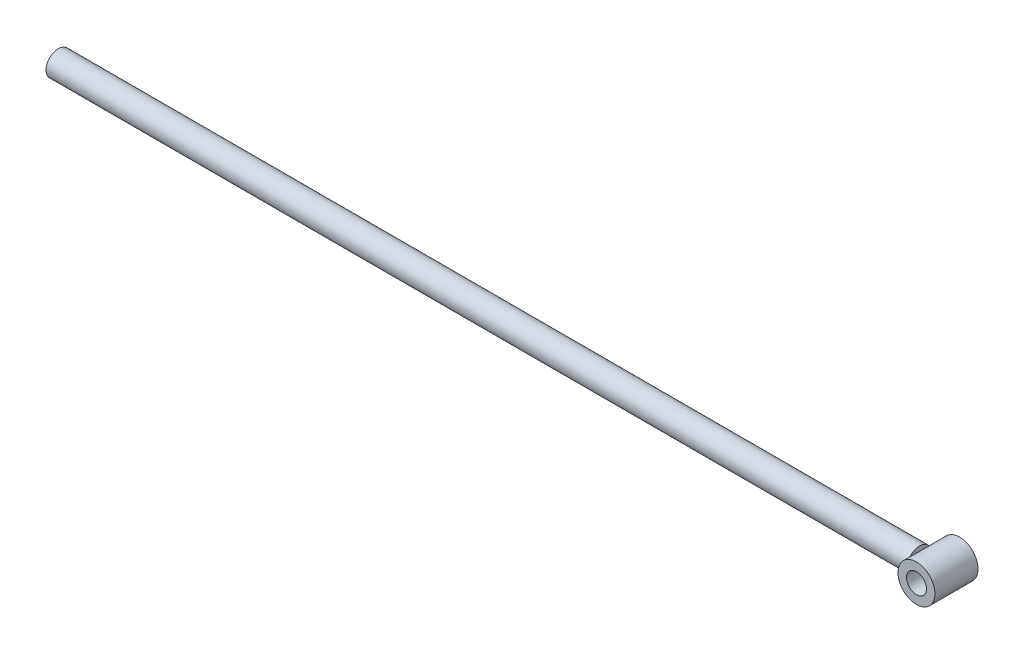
SolidWorks part; units mm, degrees
ref_plane "Plan de face" through (0, 0, 0) normal (0, 0, 1) x (1, 0, 0)
ref_plane "Plan de dessus" through (0, 0, 0) normal (0, 1, 0) x (1, 0, 0)
ref_plane "Plan de droite" through (0, 0, 0) normal (1, 0, 0) x (0, 0, -1)
sketch "Esquisse1" plane through (0, 0, 0) normal (1, 0, 0) x (0, 0, -1)
  circle A0 centre (0, 0) radius 10
  dimension "D1" = 20
extrude "Extrusion1" add sketch "Esquisse1" along normal blind 700
sketch "Esquisse2" plane through (0, 0, 0) normal (0, 0, 1) x (1, 0, 0)
  line L0 (700, -10) -> (700, 10) construction
  circle A0 centre (715, 0) radius 15
  circle A1 centre (715, 0) radius 8.1
  dimension "D1" = 16.2
  dimension "D2" = 30
extrude "Extrusion2" add sketch "Esquisse2" along normal mid plane 35
ref_plane "Plan1" through (687, 0, 0) normal (1, 0, 0) x (0, 0, -1)
